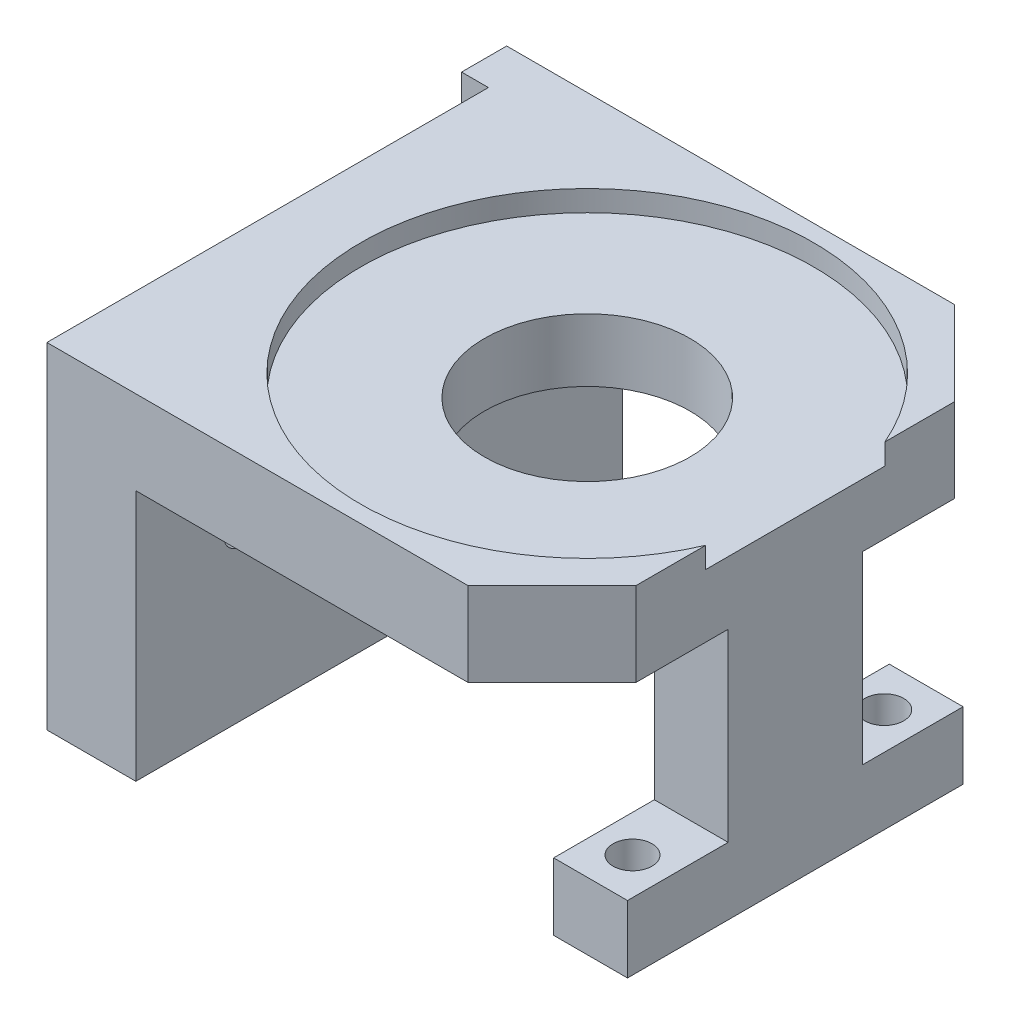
SolidWorks part; units mm, degrees
ref_plane "Front Plane" through (0, 0, 0) normal (0, 0, 1) x (1, 0, 0)
ref_plane "Top Plane" through (0, 0, 0) normal (0, 1, 0) x (1, 0, 0)
ref_plane "Right Plane" through (0, 0, 0) normal (1, 0, 0) x (0, 0, -1)
sketch "Sketch1" plane through (0, 0, 0) normal (0, 1, 0) x (1, 0, 0)
  line L0 (0, 0) -> (0, 18.415) construction
  line L1 (-22.479, 18.415) -> (15.748, 18.415)
  line L2 (-22.479, 18.415) -> (-22.479, -18.415)
  line L3 (-22.479, -18.415) -> (15.748, -18.415)
  line L4 (15.748, 18.415) -> (15.748, -18.415)
  line L5 (0, 0) -> (0, -18.415) construction
  dimension "D1" = 22.479
  dimension "D2" = 15.748
  dimension "D3" = 36.83
extrude "Boss-Extrude1" add sketch "Sketch1" against normal blind 6.35
sketch "Sketch2" plane through (0, -6.35, 0) normal (0, -1, 0) x (1, 0, 0)
  line L0 (15.748, -18.415) -> (-22.479, -18.415) construction
  line L1 (-22.479, 18.415) -> (-15.748, 18.415)
  line L2 (-22.479, 18.415) -> (-22.479, -18.415)
  line L3 (-22.479, -18.415) -> (-15.748, -18.415)
  line L4 (-15.748, 18.415) -> (-15.748, -18.415)
  line L5 (15.748, 18.415) -> (15.748, -18.415) construction
  line L6 (15.748, -5.08) -> (10.16, -5.08)
  line L7 (15.748, -5.08) -> (15.748, 5.08)
  line L8 (15.748, 5.08) -> (10.16, 5.08)
  line L9 (10.16, -5.08) -> (10.16, 5.08)
  line L10 (10.16, 0) -> (0, 0) construction
  dimension "D1" = 6.731
  dimension "D2" = 5.588
  dimension "D3" = 10.16
extrude "Boss-Extrude2" add sketch "Sketch2" along normal blind 19.05
sketch "Sketch3" plane through (0, -25.4, 0) normal (0, -1, 0) x (1, 0, 0)
  line L1 (15.748, 12.7) -> (10.16, 12.7)
  line L2 (15.748, 12.7) -> (15.748, -12.7)
  line L3 (15.748, -12.7) -> (10.16, -12.7)
  line L4 (10.16, 12.7) -> (10.16, -12.7)
  line L5 (10.16, 5.08) -> (10.16, -5.08) construction
  line L6 (10.16, 0) -> (0, 0) construction
  line L7 (15.748, -5.08) -> (15.748, 5.08) construction
  dimension "D1" = 25.4
extrude "Boss-Extrude3" add sketch "Sketch3" against normal blind 5.08
sketch "Sketch4" plane through (-22.479, 0, 0) normal (-1, 0, 0) x (0, 0, 1)
  line L0 (18.415, -25.4) -> (-18.415, -25.4) construction
  line L1 (-18.415, 0) -> (-15, 0)
  line L2 (-18.415, 0) -> (-18.415, -25.4)
  line L3 (-18.415, -25.4) -> (-15, -25.4)
  line L4 (-15, 0) -> (-15, -25.4)
  dimension "D1" = 3.415
extrude "Boss-Extrude4" add sketch "Sketch4" along normal blind 2.032
sketch "Sketch5" plane through (0, 0, 0) normal (0, 1, 0) x (1, 0, 0)
  circle A0 centre (0, 0) radius 7.7788
  dimension "D1" = 15.5575
extrude "Cut-Extrude1" cut sketch "Sketch5" against normal blind 6.35
chamfer "Chamfer1" distance 6.35 angle 45 2 edges at (15.748, -3.175, -18.415) (15.748, -3.175, 18.415)
hole_wizard "#8-32 Tapped Hole1" positions "Sketch7" profile "Sketch6" tap size "#8-32" standard "ANSI Inch"
sketch "Sketch7" plane through (0, 0, -18.415) normal (0, 0, -1) x (-1, 0, 0)
  line L0 (19.4247, -3.175) -> (19.4247, -22.225) construction
  line L2 (19.4247, -12.7) -> (24.511, -12.7) construction
  line L3 (24.511, 0) -> (24.511, -25.4) construction
  point P0 (19.4247, -3.175)
  point P2 (19.4247, -22.225)
  dimension "D1" = 19.05
sketch "Sketch6" plane through (-19.4247, -3.175, -18.415) normal (1, 0, 0) x (0, 1, 0)
  line L0 (0, 0) -> (0, 10.16)
  line L1 (0, 10.16) -> (1.7272, 10.16)
  line L2 (1.7272, 10.16) -> (1.7272, 0)
  line L5 (1.7272, 0) -> (0, 0)
  line L10 (0, 10.16) -> (-1.7272, 10.16) construction
  line L11 (0, -6.35) -> (0, 107.95) construction
  dimension "Tap Drill Dia." = 3.4544
  dimension "Tap Drill Depth" = 10.16
  dimension "Drill Angle" = 180
hole_wizard "M3x0.5 Tapped Hole1" positions "Sketch9" profile "Sketch8" tap size "M3x0.5" standard "ANSI Metric"
sketch "Sketch9" plane through (-15.748, 0, 0) normal (1, 0, 0) x (0, 0, -1)
  line L0 (-10.5, -12.7) -> (10.5, -12.7) construction
  line L2 (0, -12.7) -> (0, 0) construction
  point P0 (-10.5, -12.7)
  point P2 (10.5, -12.7)
  dimension "D1" = 21
  dimension "D2" = 12.7
sketch "Sketch8" plane through (-15.748, -12.7, 10.5) normal (0, 1, 0) x (0, 0, -1)
  line L0 (0, 0) -> (0, 7.493)
  line L1 (0, 7.493) -> (1.25, 7.493)
  line L2 (1.25, 7.493) -> (1.25, 0)
  line L5 (1.25, 0) -> (0, 0)
  line L10 (0, 7.493) -> (-1.25, 7.493) construction
  line L11 (0, -6.35) -> (0, 107.95) construction
  dimension "Tap Drill Dia." = 2.5
  dimension "Tap Drill Depth" = 7.493
  dimension "Drill Angle" = 180
hole_wizard "#4 Clearance Hole1" positions "Sketch11" profile "Sketch10" hole size "#4" standard "ANSI Inch"
sketch "Sketch11" plane through (0, -25.4, 0) normal (0, -1, 0) x (-1, 0, 0)
  line L2 (-10.16, 0) -> (-15.748, 0) construction
  line L3 (-10.16, -12.7) -> (-10.16, 12.7) construction
  line L4 (-15.748, 12.7) -> (-15.748, -12.7) construction
  line L6 (-12.954, 0) -> (-12.954, -9.525) construction
  line L8 (-12.954, 0) -> (-12.954, 9.525) construction
  point P0 (-12.954, -9.525)
  point P2 (-12.954, 9.525)
  dimension "D1" = 19.05
sketch "Sketch10" plane through (12.954, -25.4, 9.525) normal (1, 0, 0) x (0, 0, -1)
  line L0 (0, 0) -> (0, 8.255)
  line L1 (0, 8.255) -> (1.4732, 8.255)
  line L2 (1.4732, 8.255) -> (1.4732, 0)
  line L5 (1.4732, 0) -> (0, 0)
  line L10 (0, 8.255) -> (-1.4732, 8.255) construction
  line L11 (0, -6.35) -> (0, 107.95) construction
  dimension "Hole Dia." = 2.9464
  dimension "Hole Depth" = 8.255
  dimension "Drill Angle" = 180
hole_wizard "#4-40 Tapped Hole1" positions "Sketch13" profile "Sketch12" tap size "#4-40" standard "ANSI Inch"
sketch "Sketch13" plane through (0, -25.4, 0) normal (0, -1, 0) x (-1, 0, 0)
  line L0 (15.748, 0) -> (22.479, 0) construction
  line L1 (15.748, 18.415) -> (15.748, -18.415) construction
  line L2 (22.479, -18.415) -> (22.479, 15) construction
  line L4 (19.1135, 0) -> (19.1135, -6.985) construction
  line L6 (19.1135, 0) -> (19.1135, 6.985) construction
  point P0 (19.1135, -6.985)
  point P2 (19.1135, 6.985)
  dimension "D1" = 13.97
sketch "Sketch12" plane through (-19.1135, -25.4, 6.985) normal (1, 0, 0) x (0, 0, -1)
  line L0 (0, 0) -> (0, 7.5946)
  line L1 (0, 7.5946) -> (1.1303, 7.5946)
  line L2 (1.1303, 7.5946) -> (1.1303, 0)
  line L5 (1.1303, 0) -> (0, 0)
  line L10 (0, 7.5946) -> (-1.1303, 7.5946) construction
  line L11 (0, -6.35) -> (0, 107.95) construction
  dimension "Tap Drill Dia." = 2.2606
  dimension "Tap Drill Depth" = 7.5946
  dimension "Drill Angle" = 180
sketch "Sketch14" plane through (0, 0, 0) normal (0, 1, 0) x (1, 0, 0)
  circle A0 centre (0, 0) radius 17.145
  dimension "D1" = 34.29
extrude "Cut-Extrude2" cut sketch "Sketch14" against normal blind 1.5875
